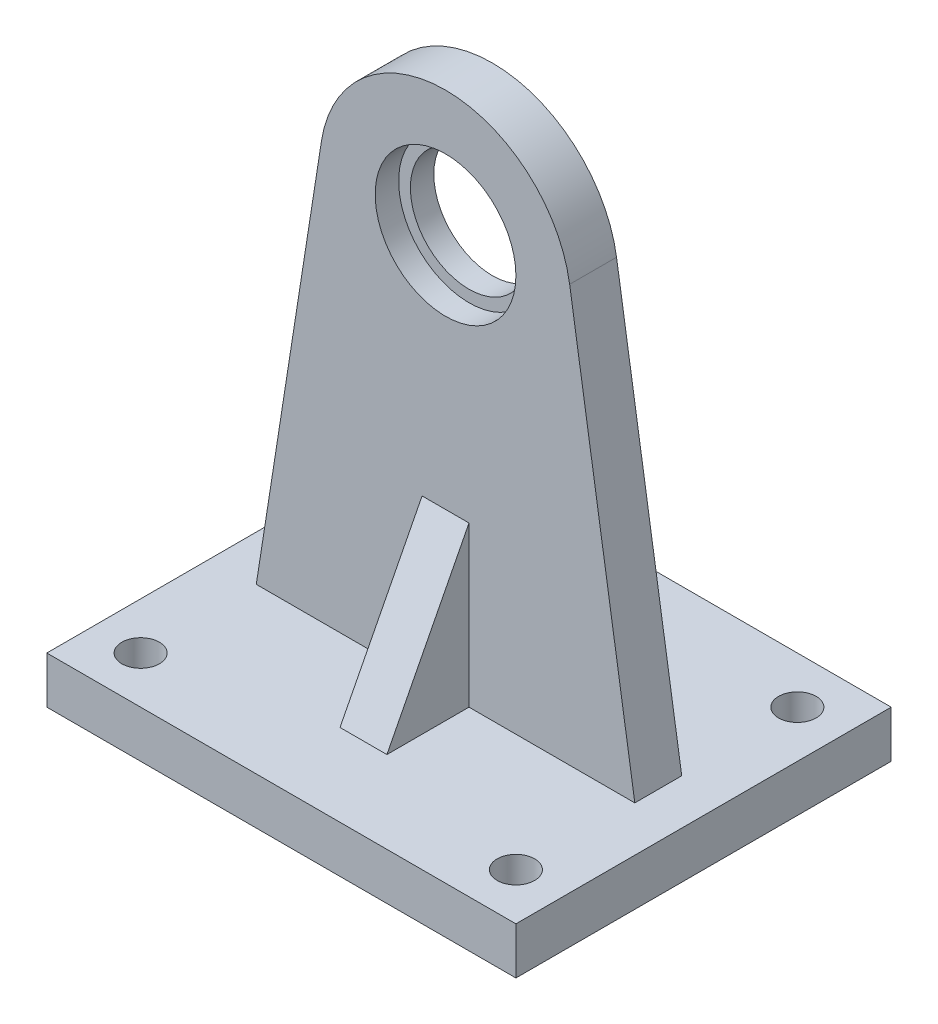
SolidWorks part; units mm, degrees
ref_plane "Front" through (0, 0, 0) normal (0, 0, 1) x (1, 0, 0)
ref_plane "Top" through (0, 0, 0) normal (0, 1, 0) x (1, 0, 0)
ref_plane "Right" through (0, 0, 0) normal (1, 0, 0) x (0, 0, -1)
sketch "Sketch1" plane through (0, 0, 0) normal (0, 1, 0) x (1, 0, 0)
  line L0 (31.75, 25.4) -> (-31.75, -25.4) construction
  line L1 (-31.75, 25.4) -> (31.75, 25.4)
  line L2 (-31.75, 25.4) -> (-31.75, -25.4)
  line L3 (-31.75, -25.4) -> (31.75, -25.4)
  line L4 (31.75, 25.4) -> (31.75, -25.4)
  dimension "D1" = 63.5
  dimension "D2" = 50.8
extrude "Extrude1" add sketch "Sketch1" along normal blind 6.35
sketch "Sketch2" plane through (0, 0, 0) normal (0, 0, 1) x (1, 0, 0)
  line L0 (0, 0) -> (0, 74.6075) construction
  line L1 (-25.6207, 6.35) -> (-16.7977, 62.7304)
  line L2 (-31.75, 6.35) -> (31.75, 6.35) construction
  line L3 (25.6207, 6.35) -> (16.7977, 62.7304)
  line L4 (-25.6207, 6.35) -> (25.6207, 6.35)
  arc A0 (-16.7977, 62.7304) -> (16.7977, 62.7304) centre (0, 60.1017) cw
extrude "Extrude2" add sketch "Sketch2" along normal mid plane 6.35
sketch "Sketch3" plane through (0, 0, 0) normal (1, 0, 0) x (0, 0, -1)
  line L0 (0, 0) -> (0, 79.9972) construction
  line L1 (-14.2875, 6.35) -> (-3.175, 27.94)
  line L2 (-25.4, 6.35) -> (25.4, 6.35) construction
  line L3 (-3.175, 6.35) -> (-3.175, 62.7304) construction
  line L4 (14.2875, 6.35) -> (3.175, 27.94)
  line L5 (-14.2875, 6.35) -> (14.2875, 6.35)
  line L6 (3.175, 27.94) -> (-3.175, 27.94)
  dimension "D1" = 21.59
  dimension "D2" = 28.575
extrude "Extrude3" add sketch "Sketch3" along normal mid plane 6.35
sketch "Sketch4" plane through (0, 0, 3.175) normal (0, 0, 1) x (1, 0, 0)
  circle A0 centre (0, 60.1017) radius 9.525
  dimension "D1" = 19.05
extrude "Cut-Extrude1" cut sketch "Sketch4" against normal blind 3.175
sketch "Sketch5" plane through (0, 0, 0) normal (0, 0, 1) x (1, 0, 0)
  circle A0 centre (0, 60.1017) radius 7.9375
  dimension "D1" = 15.875
extrude "Cut-Extrude2" cut sketch "Sketch5" against normal through all
sketch "Sketch6" plane through (0, 6.35, 0) normal (0, 1, 0) x (-1, 0, 0)
  line L0 (0, 0) -> (0, 28.6178) construction
  line L1 (0, 0) -> (35.8488, 0) construction
  line L2 (31.75, 25.4) -> (-31.75, 25.4) construction
  line L3 (31.75, -25.4) -> (31.75, 25.4) construction
  circle A0 centre (25.4, 19.05) radius 2.54
  circle A1 centre (-25.4, 19.05) radius 2.54
  circle A2 centre (-25.4, -19.05) radius 2.54
  circle A3 centre (25.4, -19.05) radius 2.54
  dimension "D1" = 5.08
  dimension "D2" = 6.35
  dimension "D3" = 6.35
extrude "Cut-Extrude3" cut sketch "Sketch6" against normal through all
